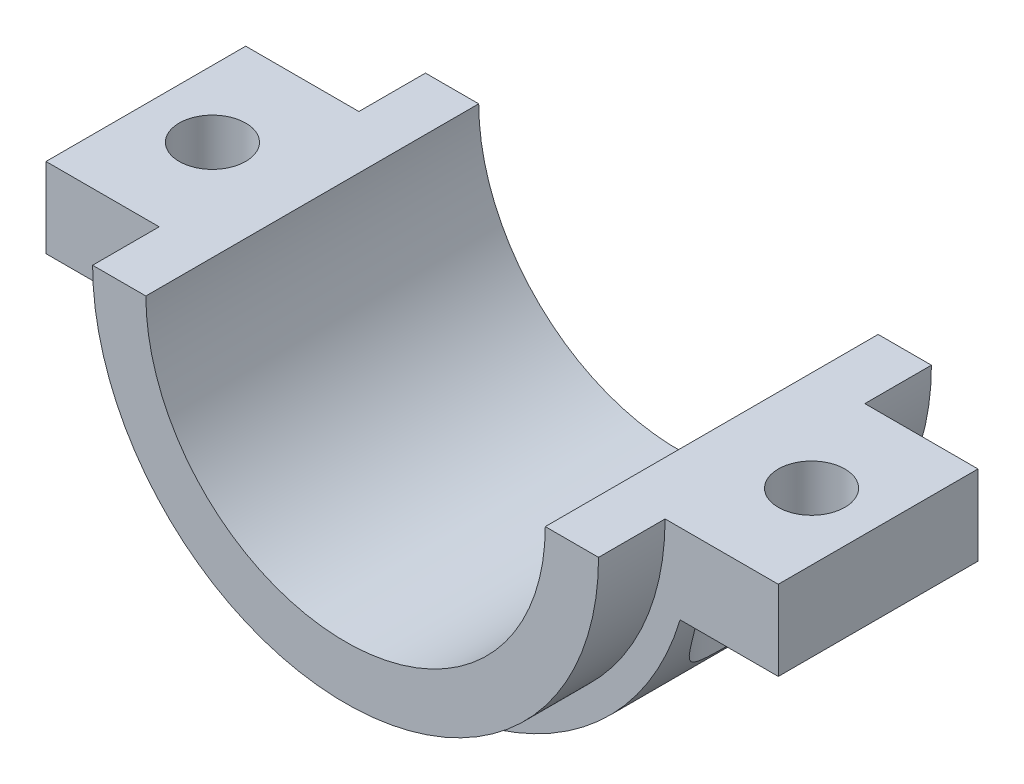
SolidWorks part; units mm, degrees
ref_plane "Płaszczyzna przednia" through (0, 0, 0) normal (0, 0, 1) x (1, 0, 0)
ref_plane "Płaszczyzna górna" through (0, 0, 0) normal (0, 1, 0) x (1, 0, 0)
ref_plane "Płaszczyzna prawa" through (0, 0, 0) normal (1, 0, 0) x (0, 0, -1)
sketch "Szkic1" plane through (0, 0, 0) normal (0, 0, 1) x (1, 0, 0)
  line L0 (30, 0) -> (55, 0)
  line L1 (-55, 0) -> (-30, 0)
  line L2 (-55, 0) -> (-55, -12)
  line L3 (-55, -12) -> (-40.2492, -12)
  line L4 (55, 0) -> (55, -12)
  line L5 (40.2492, -12) -> (55, -12)
  arc A0 (-40.2492, -12) -> (40.2492, -12) centre (0, 0) ccw
  arc A1 (-30, 0) -> (30, 0) centre (0, 0) ccw
  dimension "D2" = 30
  dimension "D3" = 42
  dimension "D1" = 110
  dimension "D4" = 12
extrude "Wyciągnięcie1" add sketch "Szkic1" along normal mid plane 30
sketch "Szkic2" plane through (0, 0, 0) normal (0, 0, 1) x (1, 0, 0)
  line L0 (55, 0) -> (30, 0) construction
  line L1 (-30, 0) -> (-55, 0) construction
  line L2 (-38, 0) -> (-30, 0)
  line L3 (30, 0) -> (38, 0)
  arc A0 (38, 0) -> (-38, 0) centre (0, 0) cw
  arc A1 (-30, 0) -> (30, 0) centre (0, 0) ccw construction
  arc A2 (-30, 0) -> (30, 0) centre (0, 0) ccw
  dimension "D1" = 38
extrude "Wyciągnięcie2" add sketch "Szkic2" along normal mid plane 50
sketch "Szkic3" plane through (0, -12, 0) normal (0, -1, 0) x (1, 0, 0)
  line L0 (0, 0) -> (0, 25) construction
  line L1 (38, 25) -> (-38, 25) construction
  circle A0 centre (45, 0) radius 13
  dimension "D2" = 13
  dimension "D1" = 90
extrude "Wytnij-wyciągnięcie1" cut sketch "Szkic3" along normal through all
sketch "Szkic4" plane through (0, -12, 0) normal (0, -1, 0) x (1, 0, 0)
  circle A0 centre (45, 0) radius 5
  arc A1 (40.2492, 12.1008) -> (40.2492, -12.1008) centre (45, 0) ccw construction
  dimension "D1" = 10
extrude "Wytnij-wyciągnięcie2" cut sketch "Szkic4" against normal through all
mirror "Lustro2" about plane through (0, 0, 0) normal (1, 0, 0) of "Wytnij-wyciągnięcie2", "Wytnij-wyciągnięcie1"
chamfer "Sfazowanie1" [suppressed] distance 1 angle 45
fillet "Zaokrąglenie1" [suppressed] radius 2
